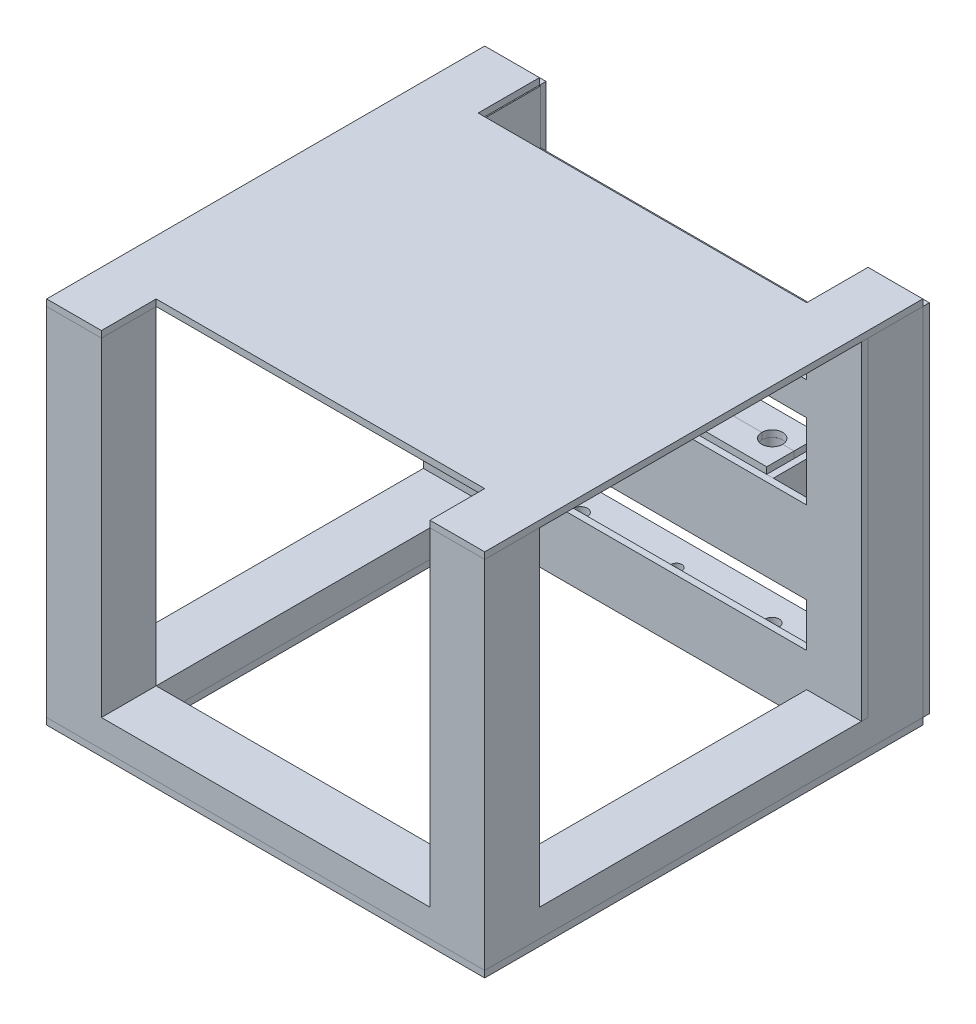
SolidWorks part; units mm, degrees
ref_plane "Front Plane" through (0, 0, 0) normal (0, 0, 1) x (1, 0, 0)
ref_plane "Top Plane" through (0, 0, 0) normal (0, 1, 0) x (1, 0, 0)
ref_plane "Right Plane" through (0, 0, 0) normal (1, 0, 0) x (0, 0, -1)
sketch "Sketch1" plane through (0, 0, 0) normal (0, 1, 0) x (1, 0, 0)
  line L0 (0, 0) -> (0, 400) construction
  line L1 (50, 50) -> (350, 50) construction
  line L2 (50, 50) -> (50, 350) construction
  line L3 (50, 350) -> (350, 350) construction
  line L4 (350, 50) -> (350, 350) construction
  line L5 (0, 400) -> (400, 400) construction
  line L6 (400, 0) -> (400, 400) construction
  line L7 (0, 0) -> (400, 0) construction
  line L9 (0, 400) -> (50, 400)
  line L10 (0, 400) -> (0, 350)
  line L11 (0, 350) -> (50, 350)
  line L12 (50, 400) -> (50, 350)
  line L13 (350, 350) -> (400, 350)
  line L14 (350, 350) -> (350, 400)
  line L15 (350, 400) -> (400, 400)
  line L16 (400, 350) -> (400, 400)
  line L17 (400, 0) -> (350, 0)
  line L18 (400, 0) -> (400, 50)
  line L19 (400, 50) -> (350, 50)
  line L20 (350, 0) -> (350, 50)
  line L21 (0, 0) -> (50, 0)
  line L22 (0, 0) -> (0, 50)
  line L23 (0, 50) -> (50, 50)
  line L24 (50, 0) -> (50, 50)
  dimension "D1" = 300
  dimension "D2" = 50
extrude "Legs" add sketch "Sketch1" along normal blind 300
sketch "Sketch2" plane through (0, 0, 0) normal (0, -1, 0) x (1, 0, 0)
  line L1 (0, 0) -> (400, 0)
  line L2 (0, 0) -> (0, -400)
  line L3 (0, -400) -> (400, -400)
  line L4 (400, 0) -> (400, -400)
  line L5 (50, -50) -> (350, -50)
  line L6 (50, -50) -> (50, -350)
  line L7 (50, -350) -> (350, -350)
  line L8 (350, -50) -> (350, -350)
extrude "Base" add sketch "Sketch2" along normal blind 25
sketch "Sketch3" plane through (50, 0, 0) normal (1, 0, 0) x (0, 0, -1)
  line L0 (350, 300) -> (350, 0) construction
  line L1 (350, 245) -> (400, 245)
  line L2 (350, 245) -> (350, 215)
  line L3 (350, 215) -> (400, 215)
  line L4 (400, 245) -> (400, 215)
  line L5 (400, 300) -> (400, 0) construction
  line L6 (350, 300) -> (400, 300) construction
  dimension "D1" = 30
  dimension "D2" = 55
extrude "Cross-Beam" add sketch "Sketch3" along normal up to surface (300 mm away)
sketch "Sketch4" plane through (0, 245, 0) normal (0, 1, 0) x (1, 0, 0)
  line L0 (50, 375) -> (350, 375) construction
  line L1 (50, 350) -> (50, 400) construction
  line L2 (350, 400) -> (350, 350) construction
  line L3 (200, 400) -> (200, 350) construction
  line L4 (350, 400) -> (50, 400) construction
  line L5 (350, 350) -> (50, 350) construction
  circle A0 centre (112.5, 375) radius 6.35
  circle A1 centre (287.5, 375) radius 6.35
  dimension "D1" = 12.7
  dimension "D2" = 175
extrude "Z Shaft Holes" cut sketch "Sketch4" against normal through all
sketch "Sketch5" plane through (0, 245, 0) normal (0, 1, 0) x (1, 0, 0)
  line L0 (200, 400) -> (200, 350) construction
  line L1 (350, 400) -> (50, 400) construction
  line L2 (350, 350) -> (50, 350) construction
  line L3 (50, 375) -> (350, 375) construction
  line L4 (50, 350) -> (50, 400) construction
  line L5 (350, 400) -> (350, 350) construction
  line L7 (178.85, 396.15) -> (221.15, 396.15) construction
  line L8 (178.85, 396.15) -> (178.85, 353.85) construction
  line L9 (178.85, 353.85) -> (221.15, 353.85) construction
  line L10 (221.15, 396.15) -> (221.15, 353.85) construction
  circle A0 centre (200, 375) radius 11.5
  dimension "D2" = 23
  dimension "D1" = 42.3
extrude "Drive Shaft Hole" cut sketch "Sketch5" against normal up to next
sketch "Z Axis Motor Mounting Holes" plane through (0, 245, 0) normal (0, 1, 0) x (1, 0, 0)
  line L0 (200, 375) -> (215.5, 390.5) construction
  line L1 (350, 400) -> (50, 400) construction
  line L2 (184.5, 390.5) -> (215.5, 359.5) construction
  circle A0 centre (215.5, 390.5) radius 2
  circle A1 centre (215.5, 359.5) radius 2
  circle A2 centre (184.5, 359.5) radius 2
  circle A3 centre (184.5, 390.5) radius 2
  dimension "D1" = 4
  dimension "D2" = 45
  dimension "D3" = 31
extrude "Motor Mounting Holes" cut sketch "Z Axis Motor Mounting Holes" against normal up to next
sketch "Sketch7" plane through (0, 0, 0) normal (0, 1, 0) x (1, 0, 0)
  circle A0 centre (200, 375) radius 11.5 construction
  circle A1 centre (200, 375) radius 11.5 construction
  circle A2 centre (200, 375) radius 5
  dimension "D1" = 10
extrude "Leadscrew Bottom Clearance" cut sketch "Sketch7" against normal up to next
sketch "Sketch8" plane through (0, 0, -400) normal (0, 0, -1) x (-1, 0, 0)
  line L0 (-350, 0) -> (-50, 0)
  line L1 (-350, 215) -> (-350, 0) construction
  line L2 (-50, 215) -> (-50, 0) construction
  line L4 (-350, 0) -> (-350, 215)
  line L5 (-350, 215) -> (-50, 215)
  line L6 (-50, 215) -> (-50, 0)
  line L8 (-50, 245) -> (-350, 245)
  line L9 (-350, 245) -> (-350, 300)
  line L10 (-350, 300) -> (-400, 300)
  line L11 (-400, 300) -> (-400, -25)
  line L12 (-400, -25) -> (0, -25)
  line L13 (0, -25) -> (0, 300)
  line L14 (0, 300) -> (-50, 300)
  line L15 (-50, 300) -> (-50, 245)
  line L16 (-50, 245) -> (-350, 245)
  line L17 (-350, 245) -> (-350, 300)
  line L18 (-350, 300) -> (-400, 300)
  line L19 (-400, 300) -> (-400, -25)
  line L20 (-400, -25) -> (0, -25)
  line L21 (0, -25) -> (0, 300)
  line L22 (0, 300) -> (-50, 300)
  line L23 (-50, 300) -> (-50, 245)
  line L24 (-50, 0) -> (-350, 0) construction
  line L25 (-350, 215) -> (-50, 215) construction
  dimension "D1" = 0
extrude "Extrude1" add sketch "Sketch8" along normal blind 6 separate body
ref_plane "Split Plane" through (0, 0, -375) normal (0, 0, 1) x (1, 0, 0)
sketch "Sketch9" plane through (0, 245, 0) normal (0, 1, 0) x (1, 0, 0)
  line L4 (350, 350) -> (350, 400)
  line L5 (350, 400) -> (50, 400)
  line L6 (50, 400) -> (50, 350)
  line L7 (50, 350) -> (350, 350)
  line L8 (350, 350) -> (350, 400)
  line L9 (350, 400) -> (50, 400)
  line L10 (50, 400) -> (50, 350)
  line L11 (50, 350) -> (350, 350)
  circle A0 centre (112.5, 375) radius 6.35 construction
  circle A1 centre (112.5, 375) radius 6.35
  circle A2 centre (287.5, 375) radius 6.35 construction
  circle A3 centre (287.5, 375) radius 6.35
  circle A4 centre (200, 375) radius 11.5 construction
  circle A5 centre (184.5, 359.5) radius 2 construction
  circle A6 centre (215.5, 359.5) radius 2 construction
  circle A7 centre (215.5, 390.5) radius 2 construction
  circle A8 centre (184.5, 390.5) radius 2 construction
  circle A9 centre (200, 375) radius 11.5
  circle A10 centre (184.5, 359.5) radius 2 construction
  circle A11 centre (215.5, 359.5) radius 2 construction
  circle A12 centre (215.5, 390.5) radius 2 construction
  circle A13 centre (184.5, 390.5) radius 2 construction
  circle A14 centre (184.5, 390.5) radius 2.1
  circle A15 centre (215.5, 390.5) radius 2.1
  circle A16 centre (215.5, 359.5) radius 2.1
  circle A17 centre (184.5, 359.5) radius 2.1
  dimension "D2" = 4.2
  dimension "D1" = 0
extrude "Extrude2" add sketch "Sketch9" along normal blind 6 separate body
sketch "Sketch10" plane through (0, 215, 0) normal (0, -1, 0) x (1, 0, 0)
  line L4 (350, -400) -> (350, -350)
  line L5 (350, -350) -> (50, -350)
  line L6 (50, -350) -> (50, -400)
  line L7 (50, -400) -> (350, -400)
  line L8 (350, -400) -> (350, -350)
  line L9 (350, -350) -> (50, -350)
  line L10 (50, -350) -> (50, -400)
  line L11 (50, -400) -> (350, -400)
  circle A0 centre (112.5, -375) radius 6.35 construction
  circle A1 centre (200, -375) radius 11.5 construction
  circle A2 centre (287.5, -375) radius 6.35 construction
  circle A3 centre (112.5, -375) radius 6.35
  circle A4 centre (200, -375) radius 11.5
  circle A5 centre (287.5, -375) radius 6.35
  circle A6 centre (215.5, -359.5) radius 2 construction
  circle A7 centre (184.5, -359.5) radius 2 construction
  circle A8 centre (184.5, -390.5) radius 2 construction
  circle A9 centre (215.5, -390.5) radius 2 construction
  circle A18 centre (215.5, -359.5) radius 2 construction
  circle A19 centre (184.5, -359.5) radius 2 construction
  circle A20 centre (184.5, -390.5) radius 2 construction
  circle A21 centre (215.5, -390.5) radius 2 construction
  circle A22 centre (215.5, -390.5) radius 2.1
  circle A23 centre (184.5, -390.5) radius 2.1
  circle A24 centre (184.5, -359.5) radius 2.1
  circle A25 centre (215.5, -359.5) radius 2.1
  dimension "D2" = 4.2
  dimension "D1" = 0
extrude "Extrude3" add sketch "Sketch10" along normal blind 6 separate body
sketch "Sketch11" plane through (0, 0, 0) normal (0, 1, 0) x (1, 0, 0)
  line L4 (50, 400) -> (50, 350)
  line L5 (50, 350) -> (350, 350)
  line L6 (350, 350) -> (350, 400)
  line L7 (350, 400) -> (50, 400)
  line L8 (50, 400) -> (50, 350)
  line L9 (50, 350) -> (350, 350)
  line L10 (350, 350) -> (350, 400)
  line L11 (350, 400) -> (50, 400)
  circle A0 centre (287.5, 375) radius 6.35 construction
  circle A1 centre (200, 375) radius 5 construction
  circle A2 centre (112.5, 375) radius 6.35 construction
  circle A3 centre (287.5, 375) radius 6.35
  circle A4 centre (200, 375) radius 5
  circle A5 centre (112.5, 375) radius 6.35
  dimension "D1" = 0
extrude "Extrude4" add sketch "Sketch11" along normal blind 6 separate body
sketch "Sketch12" plane through (0, 0, -350) normal (0, 0, 1) x (1, 0, 0)
  line L0 (50, 31) -> (350, 31)
  line L1 (50, 6) -> (350, 6) construction
  line L2 (50, 0) -> (50, -25)
  line L3 (50, -25) -> (350, -25)
  line L4 (400, -25) -> (0, -25) construction
  line L5 (350, -25) -> (350, 0)
  line L12 (350, 0) -> (400, 0)
  line L13 (400, 0) -> (400, 300)
  line L14 (400, 300) -> (350, 300)
  line L15 (350, 300) -> (350, 245)
  line L16 (350, 245) -> (50, 245)
  line L17 (50, 245) -> (50, 300)
  line L18 (50, 300) -> (0, 300)
  line L19 (0, 300) -> (0, 0)
  line L20 (0, 0) -> (50, 0)
  line L21 (50, 0) -> (50, 215)
  line L22 (50, 215) -> (350, 215)
  line L23 (350, 215) -> (350, 0)
  line L24 (350, 0) -> (400, 0)
  line L25 (400, 0) -> (400, 300)
  line L26 (400, 300) -> (350, 300)
  line L27 (350, 300) -> (350, 245)
  line L28 (350, 245) -> (50, 245)
  line L29 (50, 245) -> (50, 300)
  line L30 (50, 300) -> (0, 300)
  line L31 (0, 300) -> (0, 0)
  line L32 (0, 0) -> (50, 0)
  line L33 (50, 31) -> (50, 215)
  line L34 (50, 215) -> (350, 215)
  line L35 (350, 215) -> (350, 31)
  dimension "D2" = 25
  dimension "D1" = 0
extrude "Extrude5" add sketch "Sketch12" along normal blind 6 separate body
sketch "Sketch13" plane through (0, 0, -406) normal (0, 0, -1) x (-1, 0, 0)
  line L0 (-350, 215) -> (-350, 0) construction
  line L1 (-350, 146) -> (-50, 146)
  line L2 (-350, 146) -> (-350, 71)
  line L3 (-350, 71) -> (-50, 71)
  line L4 (-50, 146) -> (-50, 71)
  line L5 (-50, 0) -> (-50, 215) construction
  line L6 (-50, 31) -> (-350, 31) construction
  dimension "D1" = 75
  dimension "D2" = 40
extrude "Extrude6" add sketch "Sketch13" against normal blind 6
sketch "Sketch14" plane through (0, 0, -344) normal (0, 0, 1) x (1, 0, 0)
  line L1 (50, 146) -> (350, 146)
  line L2 (50, 146) -> (50, 71)
  line L3 (50, 71) -> (350, 71)
  line L4 (350, 146) -> (350, 71)
extrude "Extrude7" add sketch "Sketch14" against normal blind 6
sketch "Sketch15" plane through (0, 146, 0) normal (0, 1, 0) x (1, 0, 0)
  line L0 (50, 400) -> (350, 400) construction
  line L1 (92.5, 400) -> (307.5, 400)
  line L2 (92.5, 400) -> (92.5, 350)
  line L3 (92.5, 350) -> (307.5, 350)
  line L4 (307.5, 400) -> (307.5, 350)
  line L5 (350, 350) -> (50, 350) construction
  line L6 (200, 406) -> (200, 344) construction
  line L7 (50, 406) -> (350, 406) construction
  line L8 (350, 344) -> (50, 344) construction
  circle A0 centre (287.5, 375) radius 6.35 construction
  circle A1 centre (287.5, 375) radius 6.35 construction
  circle A2 centre (112.5, 375) radius 6.35 construction
  circle A3 centre (112.5, 375) radius 6.35 construction
  circle A4 centre (287.5, 375) radius 6.35 construction
  circle A5 centre (200, 375) radius 11.5 construction
  circle A6 centre (200, 375) radius 11.5
  circle A7 centre (112.5, 375) radius 9.525
  circle A8 centre (287.5, 375) radius 9.525
  dimension "D2" = 19.05
  dimension "D1" = 20
extrude "Extrude8" add sketch "Sketch15" against normal up to surface (75 mm away) separate body
sketch "Sketch16" plane through (0, 146, 0) normal (0, 1, 0) x (1, 0, 0)
  line L4 (92.5, 400) -> (92.5, 350)
  line L5 (92.5, 350) -> (307.5, 350)
  line L6 (307.5, 350) -> (307.5, 400)
  line L7 (307.5, 400) -> (92.5, 400)
  line L8 (92.5, 400) -> (92.5, 350)
  line L9 (92.5, 350) -> (307.5, 350)
  line L10 (307.5, 350) -> (307.5, 400)
  line L11 (307.5, 400) -> (92.5, 400)
  circle A0 centre (287.5, 375) radius 9.525 construction
  circle A1 centre (200, 375) radius 11.5 construction
  circle A2 centre (112.5, 375) radius 9.525 construction
  circle A3 centre (287.5, 375) radius 9.525
  circle A4 centre (200, 375) radius 11.5
  circle A5 centre (112.5, 375) radius 9.525
  dimension "D1" = 0
extrude "Extrude9" add sketch "Sketch16" along normal blind 6 separate body
sketch "Sketch17" plane through (0, 71, 0) normal (0, -1, 0) x (1, 0, 0)
  line L4 (92.5, -350) -> (92.5, -400)
  line L5 (92.5, -400) -> (307.5, -400)
  line L6 (307.5, -400) -> (307.5, -350)
  line L7 (307.5, -350) -> (92.5, -350)
  line L8 (92.5, -350) -> (92.5, -400)
  line L9 (92.5, -400) -> (307.5, -400)
  line L10 (307.5, -400) -> (307.5, -350)
  line L11 (307.5, -350) -> (92.5, -350)
  circle A0 centre (287.5, -375) radius 9.525 construction
  circle A1 centre (200, -375) radius 11.5 construction
  circle A2 centre (112.5, -375) radius 9.525 construction
  circle A3 centre (287.5, -375) radius 9.525
  circle A4 centre (200, -375) radius 11.5
  circle A5 centre (112.5, -375) radius 9.525
  dimension "D1" = 0
extrude "Extrude10" add sketch "Sketch17" along normal blind 6 separate body
sketch "Sketch18" plane through (92.5, 0, 0) normal (-1, 0, 0) x (0, 0, 1)
  line L4 (-400, 146) -> (-400, 71)
  line L5 (-400, 71) -> (-350, 71)
  line L6 (-350, 71) -> (-350, 146)
  line L7 (-350, 146) -> (-400, 146)
  line L8 (-400, 146) -> (-400, 71)
  line L9 (-400, 71) -> (-350, 71)
  line L10 (-350, 71) -> (-350, 146)
  line L11 (-350, 146) -> (-400, 146)
  dimension "D1" = 0
extrude "Extrude11" add sketch "Sketch18" along normal blind 6 separate body
sketch "Sketch19" plane through (307.5, 0, 0) normal (1, 0, 0) x (0, 0, -1)
  line L4 (350, 146) -> (350, 71)
  line L5 (350, 71) -> (400, 71)
  line L6 (400, 71) -> (400, 146)
  line L7 (400, 146) -> (350, 146)
  line L8 (350, 146) -> (350, 71)
  line L9 (350, 71) -> (400, 71)
  line L10 (400, 71) -> (400, 146)
  line L11 (400, 146) -> (350, 146)
  dimension "D1" = 0
extrude "Extrude12" add sketch "Sketch19" along normal blind 6 separate body
sketch "Sketch20" plane through (0, 300, 0) normal (0, 1, 0) x (1, 0, 0)
  line L0 (0, 400) -> (0, 0)
  line L1 (0, 0) -> (50, 0)
  line L2 (400, 0) -> (400, 400)
  line L3 (400, 400) -> (350, 400)
  line L4 (350, 400) -> (350, 344)
  line L5 (350, 344) -> (50, 344)
  line L6 (50, 344) -> (50, 400)
  line L7 (50, 400) -> (0, 400)
  line L8 (50, 0) -> (50, 50)
  line L9 (50, 50) -> (350, 50)
  line L10 (350, 50) -> (350, 0)
  line L11 (350, 0) -> (400, 0)
extrude "Extrude13" add sketch "Sketch20" along normal blind 6 separate body
sketch "Sketch21" plane through (0, -25, 0) normal (0, -1, 0) x (1, 0, 0)
  line L1 (50, -350) -> (350, -350)
  line L2 (50, -350) -> (50, -50)
  line L3 (50, -50) -> (350, -50)
  line L4 (0, 0) -> (0, -400)
  line L5 (0, -400) -> (400, -400)
  line L6 (400, -400) -> (400, 0)
  line L7 (400, 0) -> (0, 0)
  line L8 (0, 0) -> (0, -400)
  line L9 (0, -400) -> (400, -400)
  line L10 (400, -400) -> (400, 0)
  line L11 (400, 0) -> (0, 0)
  line L12 (350, -350) -> (350, -50)
  dimension "D1" = 0
extrude "Extrude14" add sketch "Sketch21" along normal blind 6 separate body
split "Split2" trim tools "Split Plane" bodies to split 115 123 122 116 112 resulting bodies 139 140 141 142 143 144 145 146 147 148
sketch "Sketch37" plane through (350, 0, 0) normal (-1, 0, 0) x (0, 0, 1)
  line L0 (-375, 251) -> (-400, 251) construction
  line L4 (-400, 245) -> (-350, 245)
  line L5 (-350, 245) -> (-350, 300)
  line L6 (-350, 300) -> (-400, 300)
  line L7 (-400, 300) -> (-400, 245)
  line L8 (-400, 251) -> (-350, 251)
  line L9 (-350, 251) -> (-350, 300)
  line L10 (-350, 300) -> (-400, 300)
  line L11 (-400, 300) -> (-400, 251)
  dimension "D1" = 0
extrude "Extrude21" add sketch "Sketch37" along normal blind 1 separate body
sketch "Sketch38" plane through (50, 0, 0) normal (1, 0, 0) x (0, 0, -1)
  line L1 (350, 300) -> (400, 300)
  line L2 (350, 300) -> (350, 251)
  line L3 (350, 251) -> (400, 251)
  line L4 (400, 300) -> (400, 251)
extrude "Extrude22" add sketch "Sketch38" along normal blind 1 separate body
